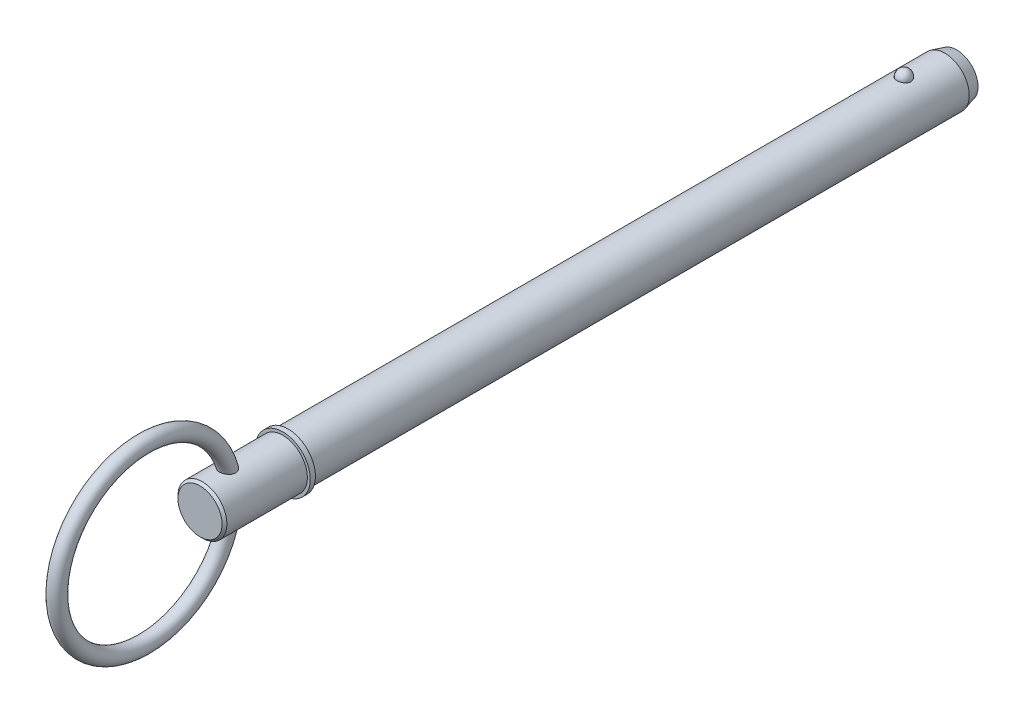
SolidWorks part; units mm, degrees
ref_plane "Front Plane" through (0, 0, 0) normal (0, 0, 1) x (1, 0, 0)
ref_plane "Top Plane" through (0, 0, 0) normal (0, 1, 0) x (1, 0, 0)
ref_plane "Right Plane" through (0, 0, 0) normal (1, 0, 0) x (0, 0, -1)
sketch "Sketch2" plane through (0, 0, 0) normal (0, 0, 1) x (1, 0, 0)
  circle A0 centre (0, 0) radius 7.145
  point P3 (0, 7.145)
  dimension "D1" = 14.29
extrude "Boss-Extrude1" add sketch "Sketch2" along normal blind 177.8
sketch "Sketch3" plane through (0, 0, 0) normal (0, 0, -1) x (-1, 0, 0)
  circle A0 centre (0, 0) radius 7.145
  dimension "D1" = 14.29
extrude "Boss-Extrude2" add sketch "Sketch3" along normal blind 17.45
chamfer "Chamfer1" distance 3.5 angle 15 1 edges at (-7.145, 0, -17.45)
sketch "Sketch18" plane through (0, 0, 0) normal (1, 0, 0) x (0, 0, -1)
  line L0 (13.95, 7.145) -> (-177.8, 7.145) construction
  line L1 (2.02, 9.165) -> (2.02, 5.125)
  line L2 (-177.8, -7.145) -> (13.95, -7.145) construction
  arc A0 (2.02, 9.165) -> (2.02, 5.125) centre (2.02, 7.145) ccw
  point P4 (0, 7.145)
  dimension "D1" = 16.31
revolve "Revolve1" add sketch "Sketch18" angle 360 about L1
sketch "Sketch19" plane through (0, 0, 0) normal (1, 0, 0) x (0, 0, -1)
  line L0 (-33.7288, 0) -> (-46.4542, 0) construction
sketch "Sketch20" plane through (0, 0, 0) normal (1, 0, 0) x (0, 0, -1)
  line L0 (-177.8, 0) -> (-177.8, 8)
  line L1 (-177.8, 7.145) -> (-177.8, -7.145) construction
  line L2 (-177.8, 8) -> (-179.3, 8)
  line L3 (-179.3, 8) -> (-179.3, 0)
  line L4 (-33.7288, 0) -> (-46.4542, 0) construction
  line L5 (-179.3, 0) -> (-177.8, 0)
  dimension "D1" = 8
  dimension "D2" = 1.5
revolve "Revolve2" add sketch "Sketch20" angle 360 about L0
sketch "Sketch21" plane through (0, 0, 177.8) normal (0, 0, -1) x (-1, 0, 0)
  circle A0 centre (0, 0) radius 7.145
  dimension "D1" = 14.29
extrude "Boss-Extrude3" add sketch "Sketch21" against normal blind 25.7
chamfer "Chamfer2" distance 0.7 angle 45 1 edges at (-7.145, 0, 203.5)
sketch "Sketch23" plane through (0, 0, 0) normal (1, 0, 0) x (0, 0, -1)
  line L0 (-203.5, 6.445) -> (-203.5, -6.445) construction
  circle A0 centre (-219.9, 0) radius 25.4
  point P2 (-194.5, 0)
  dimension "D1" = 50.8
  dimension "D2" = 9
sketch "Sketch24" plane through (0, 0, 0) normal (0, 1, 0) x (1, 0, 0)
  circle A0 centre (0, -194.5) radius 2.25
  dimension "D1" = 4.5
sweep "Sweep1" add profiles "Sketch24" path "Sketch23"
